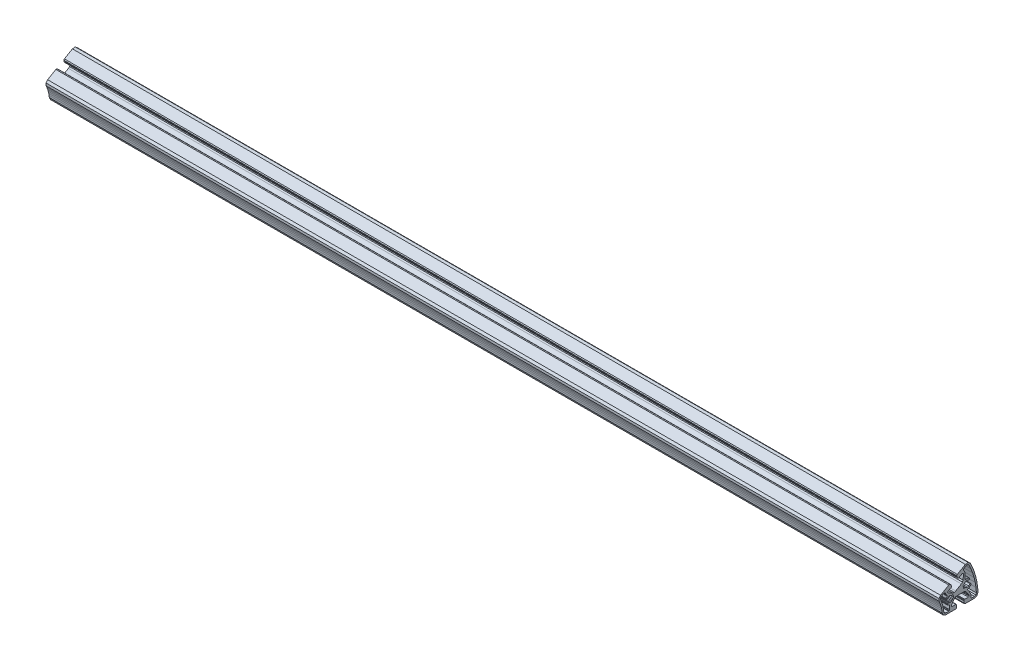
SolidWorks part; units mm, degrees
ref_plane "Ebene vorne" through (0, 0, 0) normal (0, 0, 1) x (1, 0, 0)
ref_plane "Ebene oben" through (0, 0, 0) normal (0, 1, 0) x (1, 0, 0)
ref_plane "Ebene rechts" through (0, 0, 0) normal (1, 0, 0) x (0, 0, -1)
sketch "Skizze1" plane through (0, 0, 0) normal (0, 1, 0) x (1, 0, 0)
  line L0 (0, 0) -> (1000, 0)
  dimension "D1" = 1000
other "Strukturbauteil1"
ref_plane "Ebene2" through (0, 0, 0) normal (1, 0, 0) x (0, 0, -1)
sketch "Model" plane through (0, 0, 0) normal (1, 0, 0) x (0, 0, -1)
  line L0 (-14.1377, -15.5291) -> (-3.4555, -15.5291)
  line L1 (-1.9555, -14.0291) -> (-1.9555, -12.0291)
  line L2 (-2.9555, -11.0291) -> (-7.0555, -11.0291)
  line L3 (-1.6227, -3.2791) -> (5.7116, -3.2791)
  line L4 (11.1445, -11.0291) -> (7.0445, -11.0291)
  line L5 (6.0445, -12.0291) -> (6.0445, -14.0291)
  line L6 (7.5445, -15.5291) -> (17.9391, -15.5291)
  line L7 (7.7712, 22.4182) -> (-1.2309, 17.2209)
  line L8 (-1.7799, 15.1718) -> (-0.7799, 13.4398)
  line L9 (0.5861, 13.0737) -> (4.1368, 15.1237)
  line L10 (3.3068, 5.6956) -> (-3.0448, 2.0285)
  line L11 (-11.6249, 6.0237) -> (-8.0742, 8.0737)
  line L12 (-7.7081, 9.4398) -> (-8.7081, 11.1718)
  line L13 (-10.7572, 11.7209) -> (-20.0082, 6.3798)
  line L14 (6.0553, -0.1892) -> (7.2965, 0.1434)
  line L15 (13.9445, -10.0291) -> (13.9445, -12.7291)
  line L16 (14.9445, -13.7291) -> (17.9391, -13.7291)
  line L17 (8.6712, 20.8593) -> (6.0777, 19.362)
  line L18 (5.7117, 17.996) -> (7.0617, 15.6577)
  line L19 (6.3906, 3.5241) -> (5.1494, 3.1915)
  line L20 (5.1494, 3.1915) -> (6.0553, -0.1892)
  line L21 (-9.8555, -8.6717) -> (-9.8555, -12.7291)
  line L22 (-10.8555, -13.7291) -> (-14.1377, -13.7291)
  line L23 (-19.1082, 4.8209) -> (-16.2658, 6.462)
  line L24 (-14.8997, 6.096) -> (-12.871, 2.5821)
  line L25 (-7.2965, -0.1434) -> (-6.0553, 0.1892)
  line L26 (-6.0553, 0.1892) -> (-5.1494, -3.1915)
  line L27 (-5.1494, -3.1915) -> (-6.3906, -3.5241)
  line L28 (7.7712, 22.4182) -> (10.8838, 22.7962)
  line L29 (10.8838, 22.7962) -> (13.3357, 20.769)
  line L30 (8.6712, 20.8593) -> (10.3723, 21.0704)
  line L31 (11.0037, -2.4365) -> (10.6075, -2.683)
  line L32 (13.3357, 20.769) -> (15.691, 15.7148)
  line L33 (-7.9675, -9.6189) -> (-7.8953, -10.5722)
  line L34 (-16.3235, -11.7789) -> (-15.6024, -13.1707)
  line L35 (-15.6024, -13.1707) -> (-14.1377, -13.7291)
  line L36 (-10.7116, -7.6806) -> (-12.1375, -7.1584)
  line L37 (-14.0384, 0.2159) -> (-14.1739, -0.5299)
  line L38 (-14.1739, -0.5299) -> (-13.7806, -1.0669)
  line L39 (-7.9675, -9.6189) -> (-4.6905, -4.7119)
  line L40 (-4.6905, -4.7119) -> (-3.2701, -3.6342)
  line L41 (8.7794, -4.7119) -> (12.012, -9.5293)
  line L42 (13.6598, -8.799) -> (13.8723, -9.3978)
  line L43 (21.9336, -11.3186) -> (20.8238, -14.3002)
  line L44 (7.5445, -15.5291) -> (6.4838, -15.0898)
  line L45 (20.8238, -14.3002) -> (17.9391, -15.5291)
  line L46 (6.4838, -15.0898) -> (6.0445, -14.0291)
  line L47 (8.4084, 7.6355) -> (9.3326, 7.7779)
  line L48 (4.1368, 15.1237) -> (5.0925, 15.1479)
  line L49 (5.6317, 14.3584) -> (5.2472, 8.4703)
  line L50 (-6.3236, 1.7025) -> (-4.6491, 1.5122)
  line L51 (-11.6263, 4.2911) -> (-6.3236, 1.7025)
  line L52 (-11.2068, -5.6156) -> (-10.2629, -5.9342)
  line L53 (-10.2629, -5.9342) -> (-9.2671, -5.9655)
  line L54 (-16.2658, 6.462) -> (-15.5069, 6.5619)
  line L55 (-10.8555, -13.7291) -> (-10.1484, -13.4362)
  line L56 (12.5672, 0.823) -> (13.1254, 1.1856)
  line L57 (10.6075, -2.683) -> (10.3663, -3.0825)
  line L58 (10.576, -4.0563) -> (12.2162, -6.304)
  line L59 (9.3326, 7.7779) -> (10.2673, 7.7525)
  line L60 (10.2673, 7.7525) -> (11.1823, 7.5601)
  line L61 (12.1359, 7.1592) -> (12.5385, 6.6291)
  line L62 (7.2965, 0.1434) -> (8.5662, -0.6313)
  line L63 (10.3723, 21.0704) -> (11.7543, 19.9077)
  line L64 (6.0777, 19.362) -> (5.7117, 17.996)
  line L65 (7.0617, 15.6577) -> (7.4357, 14.3502)
  line L66 (7.1309, 8.8008) -> (7.4362, 7.8527)
  line L67 (7.4362, 7.8527) -> (8.4084, 7.6355)
  line L68 (11.1823, 7.5601) -> (12.1359, 7.1592)
  line L69 (12.5385, 6.6291) -> (12.4667, 5.9673)
  line L70 (12.4667, 5.9673) -> (11.9597, 5.5359)
  line L71 (11.9597, 5.5359) -> (11.295, 5.5709)
  line L72 (11.295, 5.5709) -> (9.7653, 5.9865)
  line L73 (9.7653, 5.9865) -> (8.3044, 5.7066)
  line L74 (8.3044, 5.7066) -> (7.1029, 4.8298)
  line L75 (7.1029, 4.8298) -> (6.3906, 3.5241)
  line L76 (8.5662, -0.6313) -> (10.0451, -0.7898)
  line L77 (10.0451, -0.7898) -> (11.4502, -0.3019)
  line L78 (11.4502, -0.3019) -> (12.5672, 0.823)
  line L79 (13.1254, 1.1856) -> (13.7801, 1.0655)
  line L80 (13.7801, 1.0655) -> (14.1732, 0.5283)
  line L81 (14.1732, 0.5283) -> (14.0896, -0.1321)
  line L82 (14.0896, -0.1321) -> (13.4642, -0.9561)
  line L83 (13.4642, -0.9561) -> (12.768, -1.5802)
  line L84 (12.768, -1.5802) -> (11.9712, -2.0696)
  line L85 (11.9712, -2.0696) -> (11.0037, -2.4365)
  line L86 (10.3663, -3.0825) -> (10.3326, -3.5479)
  line L87 (10.3326, -3.5479) -> (10.576, -4.0563)
  line L88 (12.2162, -6.304) -> (13.6598, -8.799)
  line L89 (13.8723, -9.3978) -> (13.9445, -10.0291)
  line L90 (13.9445, -12.7291) -> (14.2373, -13.4362)
  line L91 (14.2373, -13.4362) -> (14.9445, -13.7291)
  line L92 (20.1334, -11.3634) -> (19.5179, -13.0613)
  line L93 (19.5179, -13.0613) -> (17.9391, -13.7291)
  line L94 (6.0445, -12.0291) -> (6.3373, -11.322)
  line L95 (6.3373, -11.322) -> (7.0445, -11.0291)
  line L96 (11.1445, -11.0291) -> (11.9842, -10.5722)
  line L97 (11.9842, -10.5722) -> (12.012, -9.5293)
  line L98 (5.7116, -3.2791) -> (7.359, -3.6342)
  line L99 (7.359, -3.6342) -> (8.7794, -4.7119)
  line L100 (-3.2701, -3.6342) -> (-1.6227, -3.2791)
  line L101 (-7.8953, -10.5722) -> (-7.0555, -11.0291)
  line L102 (-2.9555, -11.0291) -> (-2.2484, -11.322)
  line L103 (-2.2484, -11.322) -> (-1.9555, -12.0291)
  line L104 (-1.9555, -14.0291) -> (-2.3949, -15.0898)
  line L105 (-3.4555, -15.5291) -> (-2.3949, -15.0898)
  line L106 (-18.1212, -11.8928) -> (-16.816, -14.5001)
  line L107 (-16.816, -14.5001) -> (-14.1377, -15.5291)
  line L108 (15.691, 15.7148) -> (17.6885, 10.5088)
  line L109 (17.6885, 10.5088) -> (19.3185, 5.1764)
  line L110 (19.3185, 5.1764) -> (20.5731, -0.2567)
  line L111 (20.5731, -0.2567) -> (21.4462, -5.7639)
  line L112 (21.4462, -5.7639) -> (21.9336, -11.3186)
  line L113 (20.1334, -11.3634) -> (19.6556, -5.9506)
  line L114 (19.6556, -5.9506) -> (18.803, -0.5839)
  line L115 (18.803, -0.5839) -> (17.5799, 4.7105)
  line L116 (17.5799, 4.7105) -> (15.9919, 9.9072)
  line L117 (15.9919, 9.9072) -> (14.047, 14.9811)
  line L118 (14.047, 14.9811) -> (11.7543, 19.9077)
  line L119 (-20.026, 2.039) -> (-19.058, -0.225)
  line L120 (-19.058, -0.225) -> (-18.2555, -2.4469)
  line L121 (-18.2555, -2.4469) -> (-17.5798, -4.7105)
  line L122 (-17.5798, -4.7105) -> (-17.0332, -7.0087)
  line L123 (-17.0332, -7.0087) -> (-16.6172, -9.3342)
  line L124 (-16.6172, -9.3342) -> (-16.3235, -11.7789)
  line L125 (-18.1212, -11.8928) -> (-18.3926, -9.6325)
  line L126 (-18.3926, -9.6325) -> (-18.7921, -7.3912)
  line L127 (-18.7921, -7.3912) -> (-19.3185, -5.1764)
  line L128 (-19.3185, -5.1764) -> (-19.9701, -2.9951)
  line L129 (-19.9701, -2.9951) -> (-20.7447, -0.8543)
  line L130 (-20.7447, -0.8543) -> (-21.6605, 1.2844)
  line L131 (-10.1484, -13.4362) -> (-9.8555, -12.7291)
  line L132 (-9.8555, -8.6717) -> (-10.0676, -8.056)
  line L133 (-10.0676, -8.056) -> (-10.7116, -7.6806)
  line L134 (-12.5399, -6.6281) -> (-12.1375, -7.1584)
  line L135 (-12.5399, -6.6281) -> (-12.4678, -5.9663)
  line L136 (-12.4678, -5.9663) -> (-11.9607, -5.5351)
  line L137 (-11.9607, -5.5351) -> (-11.2068, -5.6156)
  line L138 (-13.7806, -1.0669) -> (-13.1259, -1.1868)
  line L139 (-13.1259, -1.1868) -> (-12.5132, -0.7402)
  line L140 (-9.2671, -5.9655) -> (-8.305, -5.7068)
  line L141 (-8.305, -5.7068) -> (-7.4591, -5.1804)
  line L142 (-7.4591, -5.1804) -> (-6.8022, -4.4314)
  line L143 (-6.8022, -4.4314) -> (-6.3906, -3.5241)
  line L144 (-7.2965, -0.1434) -> (-8.1066, 0.4366)
  line L145 (-8.1066, 0.4366) -> (-9.05, 0.7568)
  line L146 (-9.05, 0.7568) -> (-10.0457, 0.7898)
  line L147 (-10.0457, 0.7898) -> (-11.0083, 0.5327)
  line L148 (-11.0083, 0.5327) -> (-11.855, 0.0077)
  line L149 (-11.855, 0.0077) -> (-12.5132, -0.7402)
  line L150 (-12.871, 2.5821) -> (-12.7468, 1.9429)
  line L151 (-12.7468, 1.9429) -> (-13.1168, 1.2958)
  line L152 (-13.6147, 0.7874) -> (-14.0384, 0.2159)
  line L153 (-13.6147, 0.7874) -> (-13.1168, 1.2958)
  line L154 (-15.5069, 6.5619) -> (-14.8997, 6.096)
  line L155 (-19.1082, 4.8209) -> (-20.0974, 3.6049)
  line L156 (-20.0974, 3.6049) -> (-20.026, 2.039)
  line L157 (-20.0082, 6.3798) -> (-21.8132, 4.1495)
  line L158 (-21.8132, 4.1495) -> (-21.6605, 1.2844)
  line L159 (-10.7572, 11.7209) -> (-9.6189, 11.8707)
  line L160 (-9.6189, 11.8707) -> (-8.7081, 11.1718)
  line L161 (-7.7081, 9.4398) -> (-7.6082, 8.6809)
  line L162 (-7.6082, 8.6809) -> (-8.0742, 8.0737)
  line L163 (-11.6249, 6.0237) -> (-12.1236, 5.2081)
  line L164 (-12.1236, 5.2081) -> (-11.6263, 4.2911)
  line L165 (-4.6491, 1.5122) -> (-3.0448, 2.0285)
  line L166 (3.3068, 5.6956) -> (4.556, 6.8268)
  line L167 (4.556, 6.8268) -> (5.2472, 8.4703)
  line L168 (5.0925, 15.1479) -> (5.6317, 14.3584)
  line L169 (0.5861, 13.0737) -> (-0.1727, 12.9738)
  line L170 (-0.1727, 12.9738) -> (-0.7799, 13.4398)
  line L171 (-1.7799, 15.1718) -> (-1.9298, 16.31)
  line L172 (-1.9298, 16.31) -> (-1.2309, 17.2209)
  arc A38 (7.1309, 8.8008) -> (7.4357, 14.3502) centre (-19.3321, 13.0371) ccw
  point P0 (-11.9607, -5.5351)
  point P3 (21.4462, -5.7639)
  point P10 (-12.4678, -5.9663)
  point P16 (20.5731, -0.2567)
  point P23 (19.3185, 5.1764)
  point P26 (17.6885, 10.5088)
  point P34 (11.1823, 7.5601)
  point P36 (0, 0)
  point P65 (10.6075, -2.683)
  point P68 (11.9712, -2.0696)
  point P69 (-12.5399, -6.6281)
  point P73 (15.691, 15.7148)
  point P82 (10.2673, 7.7525)
  point P87 (9.3326, 7.7779)
  point P91 (9.7653, 5.9865)
  point P97 (-14.1739, -0.5299)
  point P99 (-13.7806, -1.0669)
  point P113 (-8.1066, 0.4366)
  point P114 (-9.05, 0.7568)
  point P116 (19.6556, -5.9506)
  point P125 (-5.994, 14.4709)
  point P128 (11.9597, 5.5359)
  point P129 (12.4667, 5.9673)
  point P130 (12.5385, 6.6291)
  point P131 (2.0445, -15.5291)
  point P132 (8.3044, 5.7066)
  point P133 (0, 0)
  point P134 (-19.3185, -5.1764)
  point P135 (19.3185, 5.1764)
  point P136 (0, 0)
  point P138 (18.803, -0.5839)
  point P140 (-10.0457, 0.7898)
  point P143 (17.5799, 4.7105)
  point P146 (15.9919, 9.9072)
  point P151 (10.3663, -3.0825)
  point P152 (8.5662, -0.6313)
  point P153 (14.1732, 0.5283)
  point P154 (10.3326, -3.5479)
  point P158 (7.1029, 4.8298)
  point P161 (-11.0083, 0.5327)
  point P162 (10.0451, -0.7898)
  point P170 (11.4502, -0.3019)
  point P171 (13.7801, 1.0655)
  point P175 (13.1254, 1.1856)
  point P176 (12.768, -1.5802)
  point P180 (13.4642, -0.9561)
  point P181 (14.047, 14.9811)
  point P190 (-16.6172, -9.3342)
  point P191 (-17.0332, -7.0087)
  point P192 (-17.5798, -4.7105)
  point P193 (-18.2555, -2.4469)
  point P194 (-19.058, -0.225)
  point P196 (-18.3926, -9.6325)
  point P197 (-18.7921, -7.3912)
  point P198 (-19.3185, -5.1764)
  point P199 (-19.9701, -2.9951)
  point P200 (-20.7447, -0.8543)
  point P213 (-13.1259, -1.1868)
  point P227 (-11.855, 0.0077)
  point P228 (-10.2629, -5.9342)
  point P229 (-9.2671, -5.9655)
  point P230 (-8.305, -5.7068)
  point P231 (-7.4591, -5.1804)
  point P232 (-6.8022, -4.4314)
